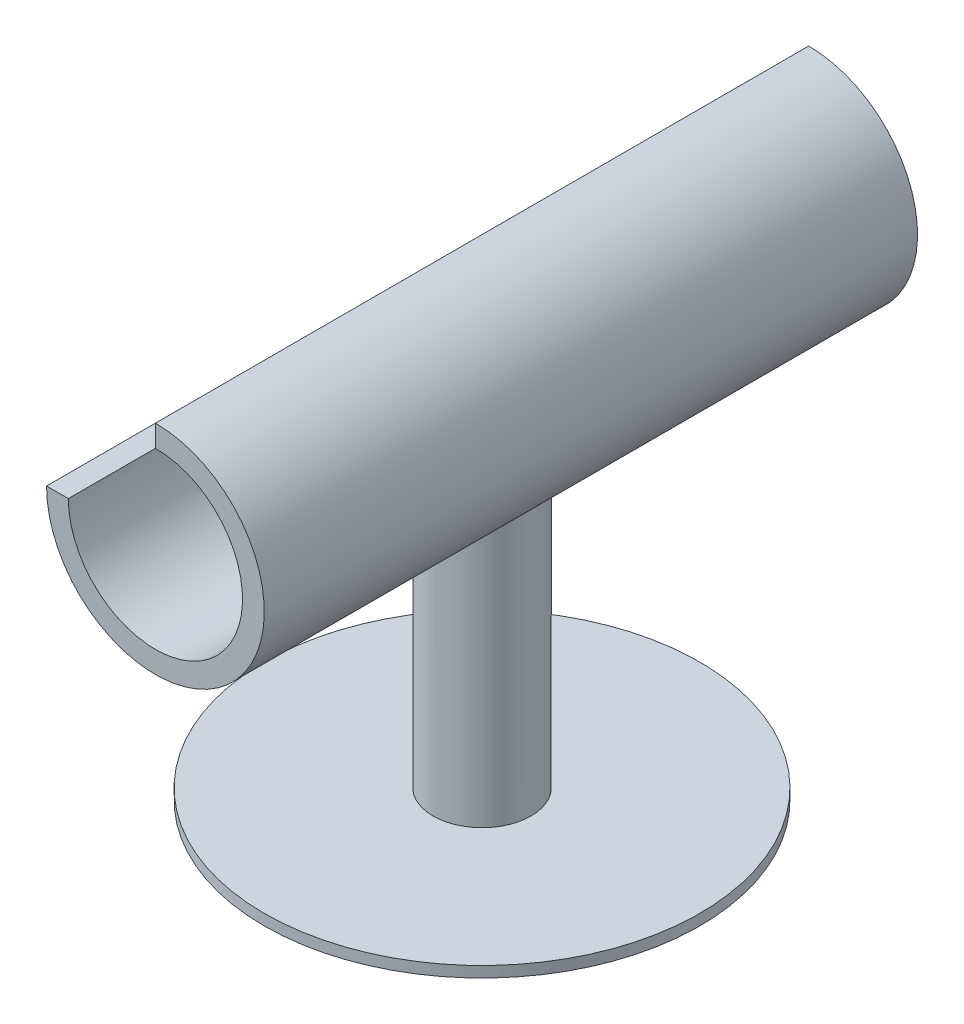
SolidWorks part; units mm, degrees
ref_plane "Plan de face" through (0, 0, 0) normal (0, 0, 1) x (1, 0, 0)
ref_plane "Plan de dessus" through (0, 0, 0) normal (0, 1, 0) x (1, 0, 0)
ref_plane "Plan de droite" through (0, 0, 0) normal (1, 0, 0) x (0, 0, -1)
sketch "Esquisse1" plane through (0, 0, 0) normal (0, 0, 1) x (1, 0, 0)
  circle A0 centre (0, 0) radius 16
  circle A1 centre (0, 0) radius 20
extrude "Boss.-Extru.1" add sketch "Esquisse1" along normal blind 120
ref_plane "Plan1" through (0, -70, 0) normal (0, 1, 0) x (-1, 0, 0)
sketch "Esquisse2" plane through (0, -70, 0) normal (0, 1, 0) x (-1, 0, 0)
  circle A0 centre (0, 60) radius 40
extrude "Boss.-Extru.2" add sketch "Esquisse2" along normal blind 2 separate body
sketch "Esquisse3" plane through (0, -68, 0) normal (0, 1, 0) x (1, 0, 0)
  circle A0 centre (0, -60) radius 9
extrude "Boss.-Extru.3" add sketch "Esquisse3" along normal up to surface (48 mm away)
sketch "Esquisse4" plane through (0, 0, 120) normal (0, 0, 1) x (1, 0, 0)
  line L1 (0, 0) -> (-36.8253, 0)
  line L2 (0, 0) -> (0, 26.3518)
  line L3 (0, 26.3518) -> (-36.8253, 26.3518)
  line L4 (-36.8253, 0) -> (-36.8253, 26.3518)
extrude "Enlèv. mat.-Extru.1" cut sketch "Esquisse4" against normal through all
